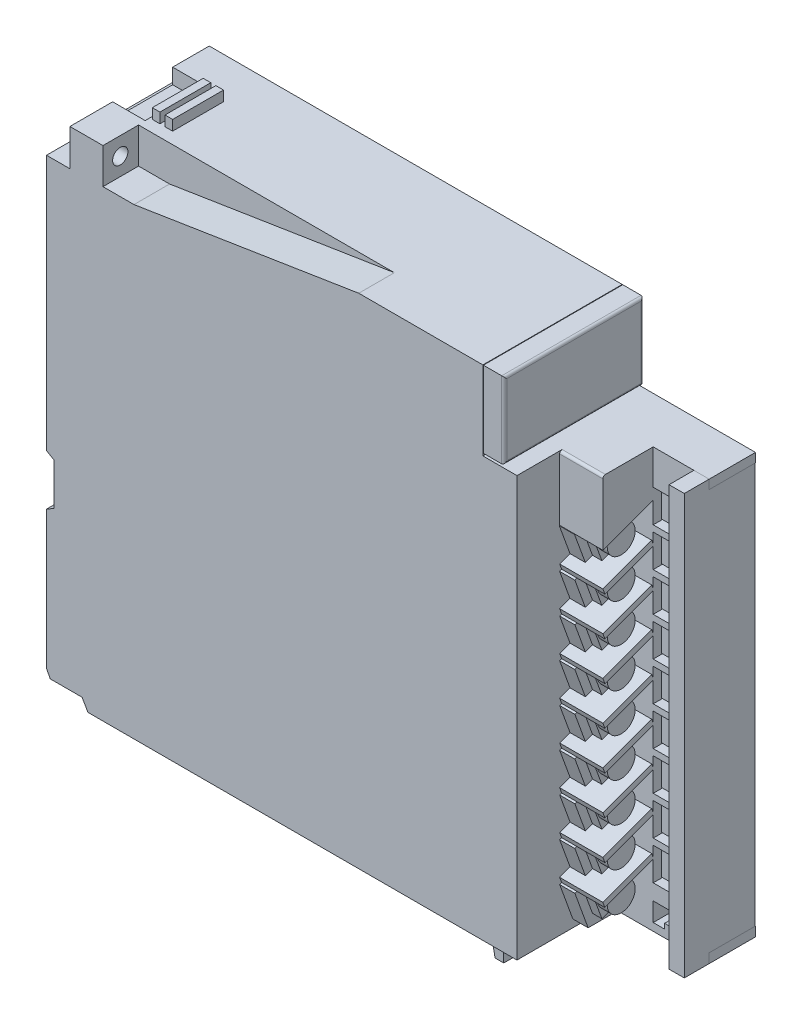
SolidWorks part; units mm, degrees
ref_plane "Front Plane" through (0, 0, 0) normal (0, 0, 1) x (1, 0, 0)
ref_plane "Top Plane" through (0, 0, 0) normal (0, 1, 0) x (1, 0, 0)
ref_plane "Right Plane" through (0, 0, 0) normal (1, 0, 0) x (0, 0, -1)
imported_body "Imported1"
imported_body "Imported2"
fillet "Fillet1" radius 0.5
